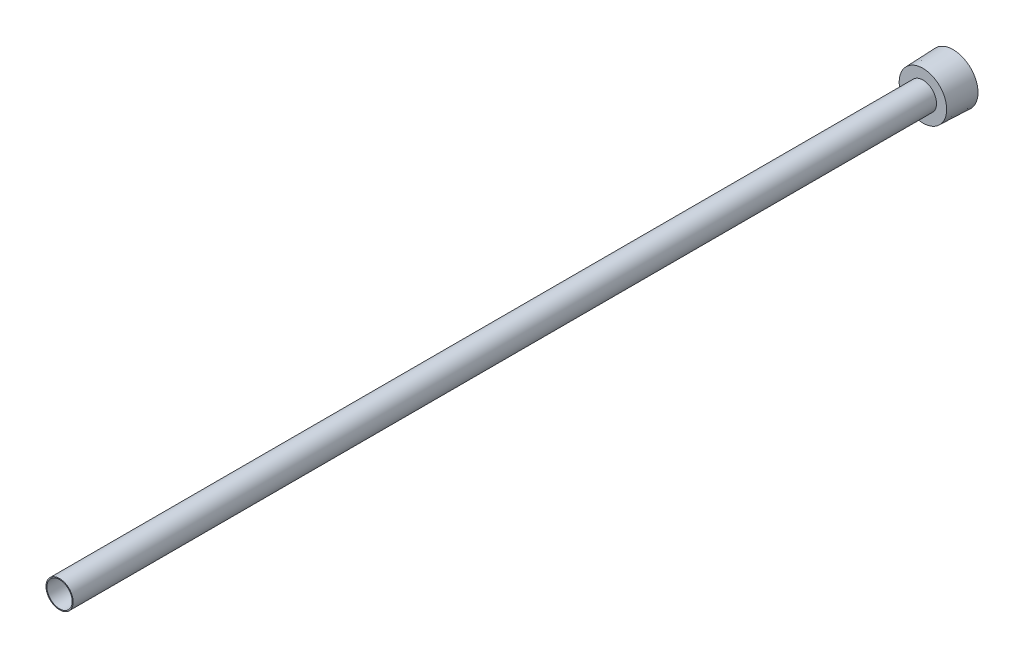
SolidWorks part; units mm, degrees
ref_plane "Front Plane" through (0, 0, 0) normal (0, 0, 1) x (1, 0, 0)
ref_plane "Top Plane" through (0, 0, 0) normal (0, 1, 0) x (1, 0, 0)
ref_plane "Right Plane" through (0, 0, 0) normal (1, 0, 0) x (0, 0, -1)
sketch "Sketch1" plane through (0, 0, 0) normal (1, 0, 0) x (0, 0, -1)
  line L0 (-168.7934, 0) -> (49831.2066, 0) construction
  line L6 (0, 0) -> (0, 8.4709)
  line L7 (0, 8.4709) -> (-10.3124, 8.0947)
  line L8 (-10.3124, 8.0947) -> (-10.3124, 4.6355)
  line L9 (-10.3124, 4.6355) -> (-304.8, 4.6355)
  line L10 (-304.8, 4.6355) -> (-304.8, 0)
  line L11 (0, 0) -> (-304.8, 0)
  dimension "D1" = 10.3124
  dimension "D2" = 16.9418
  dimension "D3" = 2.089
  dimension "D4" = 9.271
  dimension "D5" = 304.8
revolve "Revolve1" add sketch "Sketch1" angle 360 about L0
sketch "Sketch2" plane through (0, 0, 304.8) normal (0, 0, 1) x (1, 0, 0)
  circle A0 centre (0, 0) radius 4.318
  dimension "D1" = 8.636
extrude "Cut-Extrude1" cut sketch "Sketch2" against normal through all
sketch "Sketch3" plane through (0, 0, 0) normal (0, 0, -1) x (-1, 0, 0)
  line L0 (0, 9.318) -> (0, -9.318) construction
  line L1 (0, -5.4993) -> (4.7625, -2.7496)
  line L2 (4.7625, -2.7496) -> (4.7625, 2.7496)
  line L3 (4.7625, 2.7496) -> (0, 5.4993)
  line L4 (0, 5.4993) -> (-4.7625, 2.7496)
  line L5 (-4.7625, 2.7496) -> (-4.7625, -2.7496)
  line L6 (-4.7625, -2.7496) -> (0, -5.4993)
  circle A0 centre (0, 0) radius 4.7625 construction
  dimension "D1" = 9.525
extrude "Cut-Extrude2" cut sketch "Sketch3" against normal blind 6.35
